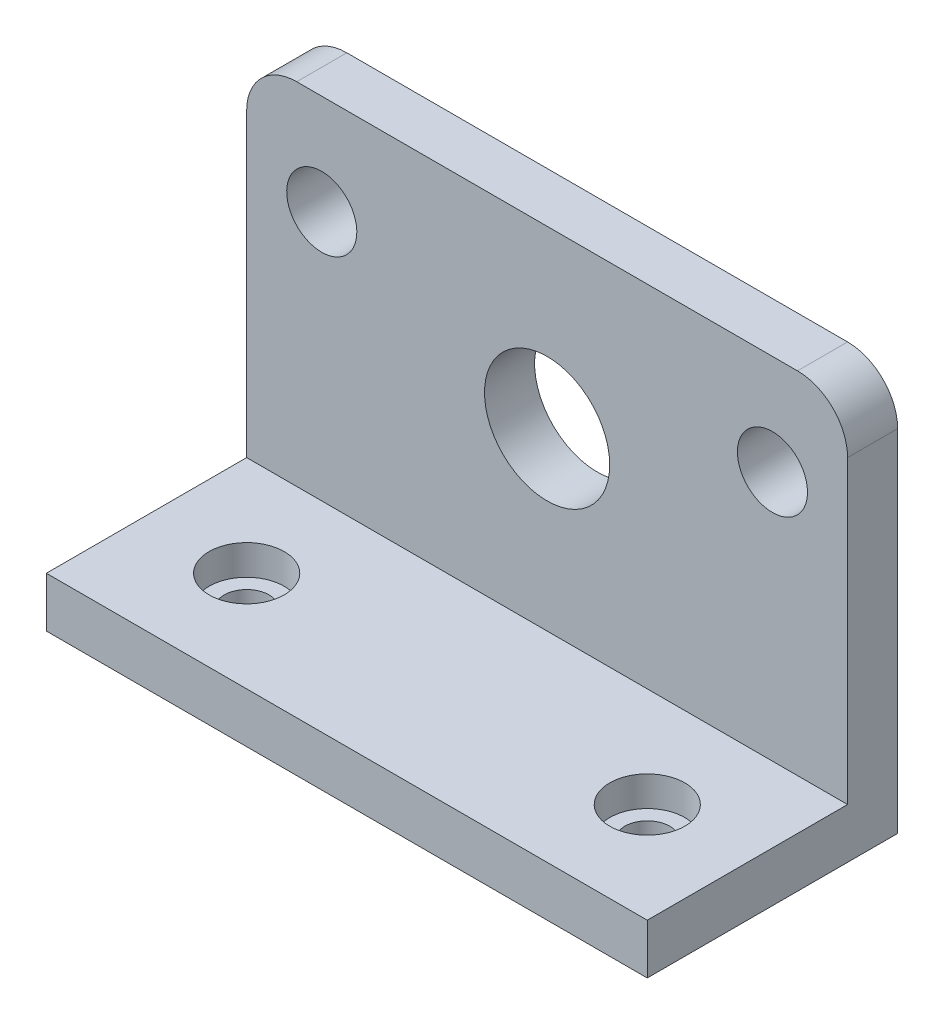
SolidWorks part; units mm, degrees
ref_plane "Ebene vorne" through (0, 0, 0) normal (0, 0, 1) x (1, 0, 0)
ref_plane "Ebene oben" through (0, 0, 0) normal (0, 1, 0) x (1, 0, 0)
ref_plane "Ebene rechts" through (0, 0, 0) normal (1, 0, 0) x (0, 0, -1)
sketch "Skizze1" plane through (0, 0, 0) normal (1, 0, 0) x (0, 0, -1)
  line L0 (0, 0) -> (50, 0)
  line L1 (50, 0) -> (50, 80)
  line L2 (50, 80) -> (40, 80)
  line L3 (40, 80) -> (40, 10)
  line L4 (40, 10) -> (0, 10)
  line L5 (0, 10) -> (0, 0)
  dimension "D1" = 50
  dimension "D2" = 80
  dimension "D3" = 10
extrude "Aufsatz-Linear austragen1" add sketch "Skizze1" along normal mid plane 120
sketch "Skizze2" plane through (0, 0, -40) normal (0, 0, 1) x (1, 0, 0)
  line L0 (-60, 80) -> (-60, 10) construction
  line L1 (60, 80) -> (-60, 80) construction
  circle A0 centre (0, 45) radius 12.5
  dimension "D1" = 25
  dimension "D2" = 60
  dimension "D3" = 35
extrude "Schnitt-Linear austragen1" cut sketch "Skizze2" against normal through all
hole_wizard "M16 Gewindebohrung1" positions "3D-Skizze1" profile "Skizze3" tap size "M16" standard "DIN"
sketch3d "3D-Skizze1"
  line L0 (-60, 80, -40) -> (-60, 10, -40) construction
  line L1 (60, 80, -40) -> (60, 10, -40) construction
  line L2 (60, 80, -40) -> (-60, 80, -40) construction
  point P0 (-45, 60, -40)
  point P2 (45, 60, -40)
  dimension "D1" = 15
  dimension "D2" = 15
  dimension "D3" = 20
  dimension "D4" = 20
sketch "Skizze3" plane through (-45, 60, -40) normal (1, 0, 0) x (0, -1, 0)
  line L0 (0, 0) -> (0, 10)
  line L1 (0, 10) -> (7, 10)
  line L2 (7, 10) -> (7, 0)
  line L5 (7, 0) -> (0, 0)
  line L11 (0, -6.35) -> (0, 107.95) construction
  dimension "Bohrerdurchmesser" = 14
  dimension "Bohrungstiefe" = 10
hole_wizard "Stirnsenkung für M8 Zylinderschraube mit Innensechskant1" positions "3D-Skizze3" profile "Skizze4" counterbore size "M8" standard "DIN"
sketch3d "3D-Skizze3"
  line L0 (60, 10, 0) -> (-60, 10, 0) construction
  line L1 (-60, 10, -40) -> (-60, 10, 0) construction
  line L2 (60, 10, -40) -> (60, 10, 0) construction
  point P0 (-40, 10, -20)
  point P2 (40, 10, -20)
  dimension "D1" = 20
  dimension "D2" = 20
  dimension "D3" = 20
  dimension "D4" = 20
sketch "Skizze4" plane through (-40, 10, -20) normal (1, 0, 0) x (0, 0, 1)
  line L0 (0, 0) -> (0, 10)
  line L1 (0, 10) -> (4.5, 10)
  line L3 (4.5, 10) -> (4.5, 6)
  line L4 (4.5, 6) -> (7.5, 6)
  line L5 (7.5, 6) -> (7.5, 0)
  line L7 (7.5, 0) -> (0, 0)
  line L11 (0, -6.35) -> (0, 107.95) construction
  dimension "Bohrerdurchmesser" = 9
  dimension "Bohrungstiefe" = 10
  dimension "Senkdurchmesser2" = 15
  dimension "Senktiefe2" = 6
fillet "Verrundung1" radius 10 2 edges at (-60, 80, -45) (60, 80, -45)
